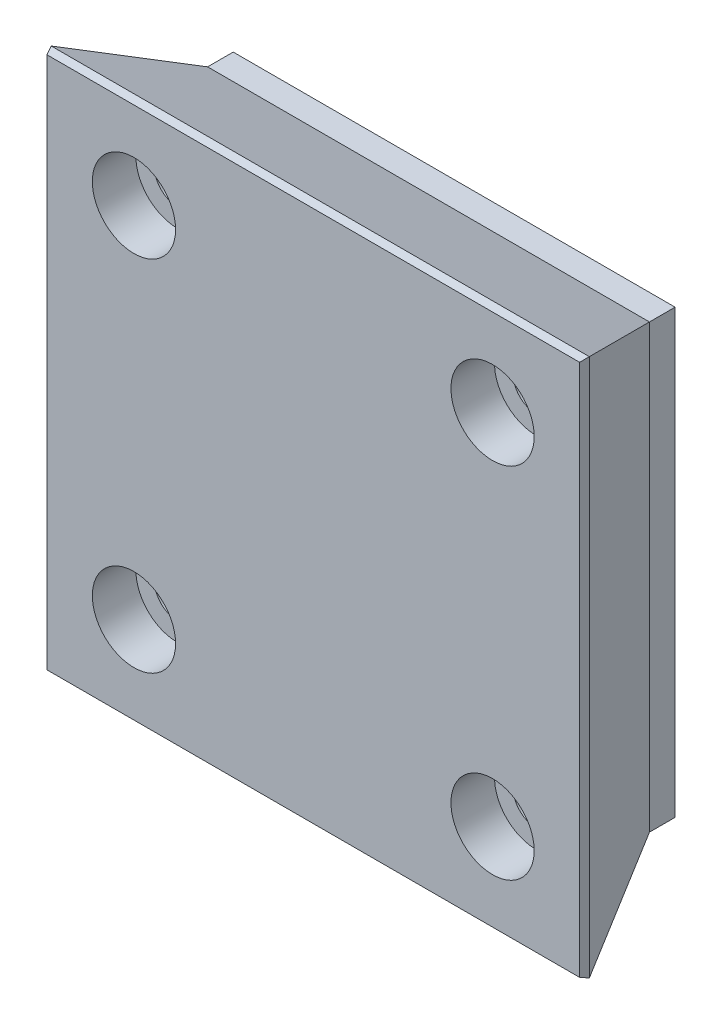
SolidWorks part; units mm, degrees
ref_plane "Ebene vorne" through (0, 0, 0) normal (0, 0, 1) x (1, 0, 0)
ref_plane "Ebene oben" through (0, 0, 0) normal (0, 1, 0) x (1, 0, 0)
ref_plane "Ebene rechts" through (0, 0, 0) normal (1, 0, 0) x (0, 0, -1)
sketch "Skizze1" plane through (0, 0, 0) normal (0, 0, 1) x (1, 0, 0)
  line L1 (-17.25, -17.25) -> (17.25, -17.25)
  line L2 (-17.25, -17.25) -> (-17.25, 17.25)
  line L3 (-17.25, 17.25) -> (17.25, 17.25)
  line L4 (17.25, -17.25) -> (17.25, 17.25)
  line L5 (-17.25, -17.25) -> (17.25, 17.25) construction
  line L6 (-17.25, 17.25) -> (17.25, -17.25) construction
  point P0 (0, 0)
  dimension "D1" = 34.5
extrude "Aufsatz-Linear austragen1" add sketch "Skizze1" along normal blind 2
ref_plane "Ebene1" through (0, 0, 11) normal (0, 0, 1) x (1, 0, 0)
sketch "Skizze2" plane through (0, 0, 11) normal (0, 0, 1) x (1, 0, 0)
  line L1 (-21.25, -21.25) -> (21.25, -21.25)
  line L2 (-21.25, -21.25) -> (-21.25, 21.25)
  line L3 (-21.25, 21.25) -> (21.25, 21.25)
  line L4 (21.25, -21.25) -> (21.25, 21.25)
  line L5 (-21.25, -21.25) -> (21.25, 21.25) construction
  line L6 (-21.25, 21.25) -> (21.25, -21.25) construction
  point P0 (0, 0)
  dimension "D1" = 42.5
loft "Ausformung1" add profiles "Skizze2"
chamfer "Fase1" distance 0.6 angle 45 4 edges
hole_wizard "Stirnsenkung für M3 Zylinderschraube mit Innensechskant1" positions "Skizze3" profile "Skizze5" counterbore size "M3" standard "DIN"
sketch "Skizze3" plane through (0, 0, 11) normal (0, 0, 1) x (1, 0, 0)
  line L1 (-14, 14) -> (14, 14)
  line L2 (-14, 14) -> (-14, -14)
  line L3 (-14, -14) -> (14, -14)
  line L4 (14, 14) -> (14, -14)
  line L5 (-14, 14) -> (14, -14) construction
  point P0 (-14, 14)
  point P2 (14, 14)
  point P4 (14, -14)
  point P6 (-14, -14)
  dimension "D1" = 28
sketch "Skizze5" plane through (-14, 14, 11) normal (1, 0, 0) x (0, -1, 0)
  line L0 (0, 0) -> (0, 11)
  line L1 (0, 11) -> (1.8, 11)
  line L3 (1.8, 11) -> (1.8, 3.4)
  line L4 (1.8, 3.4) -> (3.25, 3.4)
  line L5 (3.25, 3.4) -> (3.25, 0)
  line L7 (3.25, 0) -> (0, 0)
  line L11 (0, -6.35) -> (0, 107.95) construction
  dimension "Bohrerdurchmesser" = 3.6
  dimension "Bohrungstiefe" = 11
  dimension "Senkdurchmesser2" = 6.5
  dimension "Senktiefe2" = 3.4
